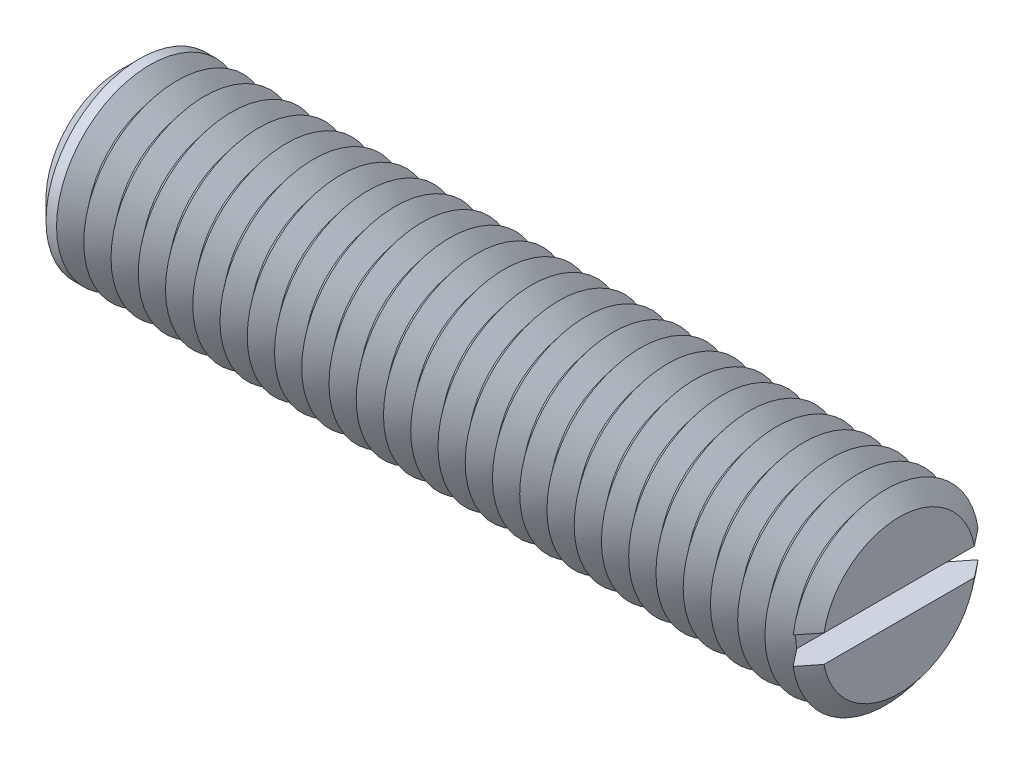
SolidWorks part; units mm, degrees
ref_plane "Front Plane" through (0, 0, 0) normal (0, 0, 1) x (1, 0, 0)
ref_plane "Top Plane" through (0, 0, 0) normal (0, 1, 0) x (1, 0, 0)
ref_plane "Right Plane" through (0, 0, 0) normal (1, 0, 0) x (0, 0, -1)
sketch "Sketch1" plane through (0, 0, 0) normal (1, 0, 0) x (0, 0, -1)
  circle A0 centre (0, 0) radius 6
  dimension "D1" = 12
extrude "Extrude1" add sketch "Sketch1" along normal mid plane 50
sketch "Sketch2" plane through (0, 0, 0) normal (0, 0, 1) x (1, 0, 0)
  line L0 (25, 0.875) -> (23.25, 0.875)
  line L1 (25, -6) -> (25, 6) construction
  line L2 (23.25, 0.875) -> (23.25, -0.875)
  line L3 (0, 0) -> (50000, 0) construction
  line L4 (25, -0.875) -> (23.25, -0.875)
  line L5 (25, -0.875) -> (25, 0.875)
  point P9 (23.25, 0)
  dimension "D1" = 1.75
extrude "Extrude2" cut sketch "Sketch2" against normal mid plane 18
chamfer "Chamfer1" distance 1.2 angle 45 1 edges at (-25, 0, -6)
sketch "Sketch3" plane through (0, 0, 0) normal (0, 0, 1) x (1, 0, 0)
  line L0 (0, 0) -> (30.9602, 0) construction
  line L1 (24.125, -6) -> (25.875, -6)
  line L2 (-23.8, -6) -> (25, -6) construction
  line L3 (25.875, -6) -> (25, -4.9071)
  line L4 (25, -6) -> (25, -0.875) construction
  line L5 (25, -4.9071) -> (24.125, -6)
  dimension "D1" = 1.75
  dimension "D2" = 1.4
revolve "Cut-Revolve1" cut sketch "Sketch3" angle 360 about L0
pattern_linear "LPattern1" count 28 spacing 1.75 along (-1, 0, 0) of "Cut-Revolve1"
equation "\"D2@Sketch3\" = \"D1@Sketch3\"*0.8"
